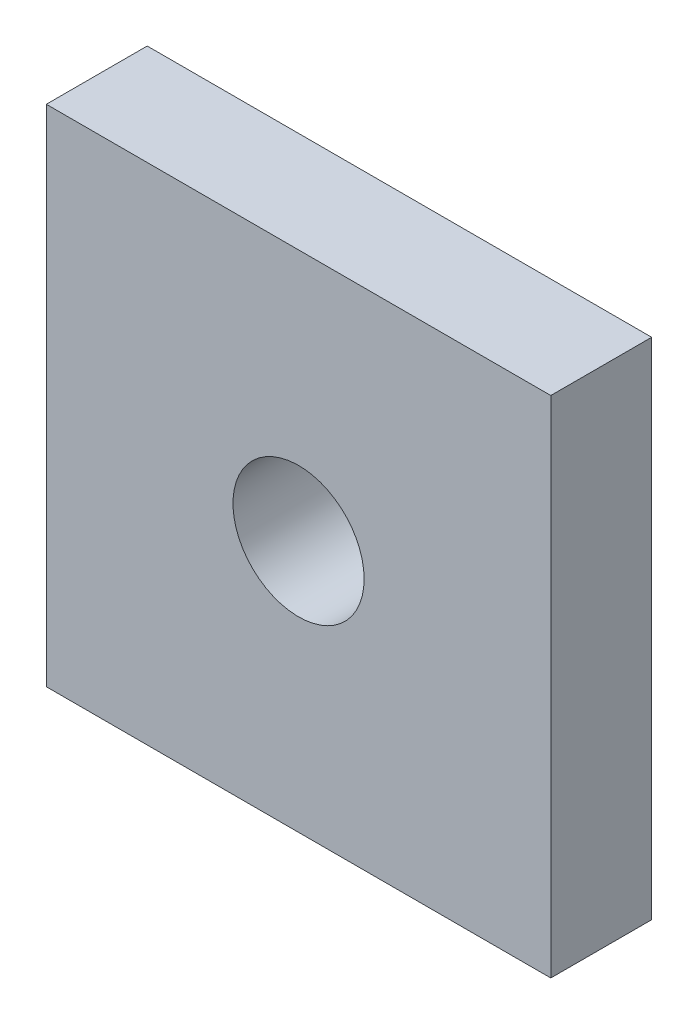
SolidWorks part; units mm, degrees
ref_plane "Plan de face" through (0, 0, 0) normal (0, 0, 1) x (1, 0, 0)
ref_plane "Plan de dessus" through (0, 0, 0) normal (0, 1, 0) x (1, 0, 0)
ref_plane "Plan de droite" through (0, 0, 0) normal (1, 0, 0) x (0, 0, -1)
sketch "Esquisse1" plane through (0, 0, 0) normal (0, 0, 1) x (1, 0, 0)
  line L1 (12.5, -12.5) -> (-12.5, -12.5)
  line L2 (12.5, -12.5) -> (12.5, 12.5)
  line L3 (12.5, 12.5) -> (-12.5, 12.5)
  line L4 (-12.5, -12.5) -> (-12.5, 12.5)
  line L5 (12.5, -12.5) -> (-12.5, 12.5) construction
  line L6 (12.5, 12.5) -> (-12.5, -12.5) construction
  point P0 (0, 0)
  dimension "D1" = 25
  dimension "D2" = 25
extrude "Boss.-Extru.1" add sketch "Esquisse1" along normal blind 5
sketch "Esquisse2" plane through (0, 0, 5) normal (0, 0, 1) x (1, 0, 0)
  circle A0 centre (0, 0) radius 3.25
  dimension "D1" = 6.5
extrude "Enlèv. mat.-Extru.1" cut sketch "Esquisse2" against normal through all
